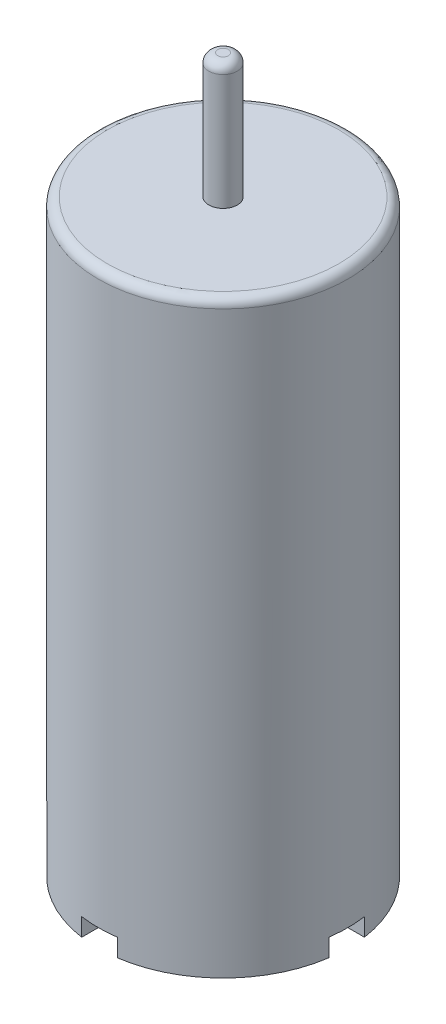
SolidWorks part; units mm, degrees
ref_plane "Front Plane" through (0, 0, 0) normal (0, 0, 1) x (1, 0, 0)
ref_plane "Top Plane" through (0, 0, 0) normal (0, 1, 0) x (1, 0, 0)
ref_plane "Right Plane" through (0, 0, 0) normal (1, 0, 0) x (0, 0, -1)
sketch "Sketch1" plane through (0, 0, 0) normal (0, 1, 0) x (1, 0, 0)
  circle A0 centre (0, 0) radius 3.5
  dimension "D1" = 7
extrude "Boss-Extrude1" add sketch "Sketch1" along normal blind 16
sketch "Sketch2" plane through (0, 0, 0) normal (0, -1, 0) x (1, 0, 0)
  line L0 (0, 3.5) -> (0, -3.5) construction
  line L1 (-3.5, 0) -> (3.5, 0) construction
  line L2 (-0.5, 2.9641) -> (0.5, 2.9641)
  line L3 (-0.5, 2.9641) -> (-0.5, 3.4641)
  line L4 (0.5, 2.9641) -> (0.5, 3.4641)
  line L5 (2.9641, 0.5) -> (3.4641, 0.5)
  line L6 (2.9641, 0.5) -> (2.9641, -0.5)
  line L7 (2.9641, -0.5) -> (3.4641, -0.5)
  line L8 (0.5, -2.9641) -> (0.5, -3.4641)
  line L9 (0.5, -2.9641) -> (-0.5, -2.9641)
  line L10 (-0.5, -2.9641) -> (-0.5, -3.4641)
  line L11 (-2.9641, -0.5) -> (-3.4641, -0.5)
  line L12 (-2.9641, -0.5) -> (-2.9641, 0.5)
  line L13 (-2.9641, 0.5) -> (-3.4641, 0.5)
  arc A0 (-3.4641, -0.5) -> (-0.5, -3.4641) centre (0, 0) ccw
  circle A1 centre (0, 0) radius 3.5 construction
  arc A2 (3.4641, 0.5) -> (0.5, 3.4641) centre (0, 0) ccw
  arc A3 (0.5, -3.4641) -> (3.4641, -0.5) centre (0, 0) ccw
  arc A4 (-0.5, 3.4641) -> (-3.4641, 0.5) centre (0, 0) ccw
  point P11 (0, 2.9641)
  point P29 (0, 0)
  dimension "D1" = 1
  dimension "D2" = 0.5
  dimension "D3" = 4
extrude "Boss-Extrude2" add sketch "Sketch2" along normal blind 0.5
sketch "Sketch3" plane through (0, 16, 0) normal (0, 1, 0) x (1, 0, 0)
  circle A0 centre (0, 0) radius 0.4
  dimension "D1" = 0.8
extrude "Boss-Extrude3" add sketch "Sketch3" along normal blind 3.5
fillet "Fillet2" radius 0.25 1 edges at (0, 16, 3.5)
fillet "Fillet3" radius 0.25 1 edges at (0, 19.5, 0.4)
